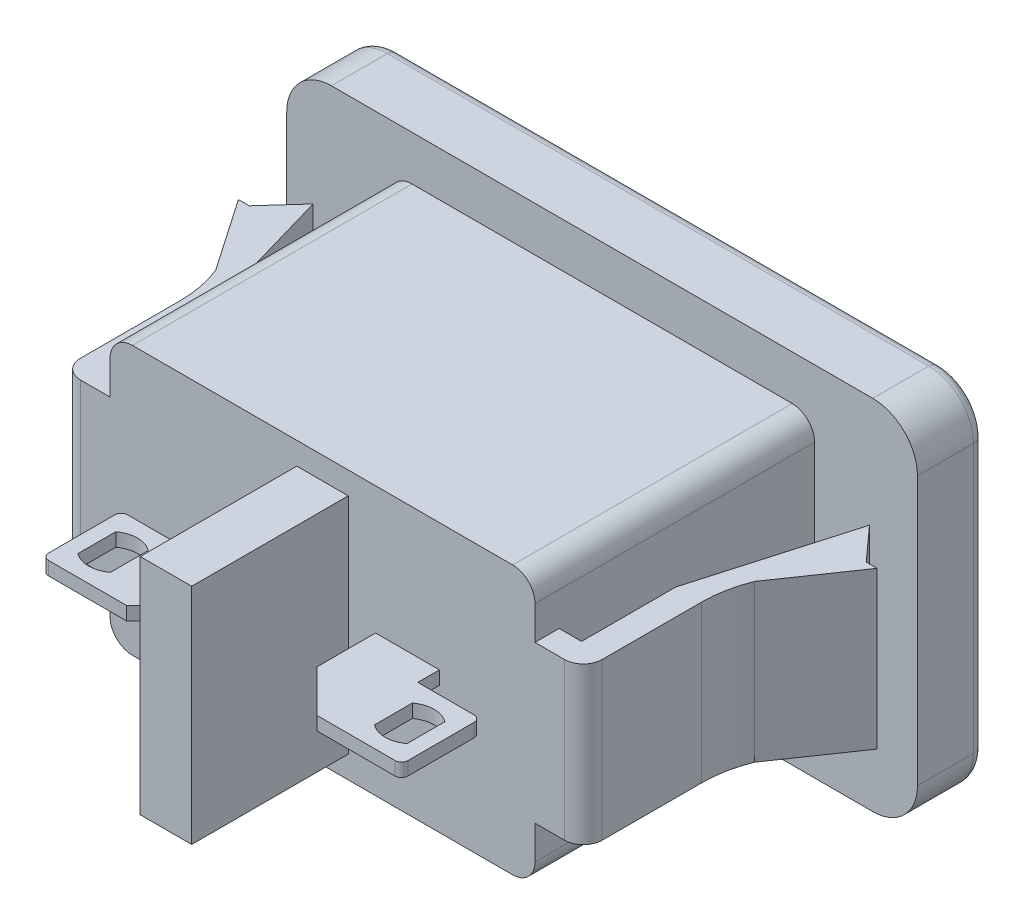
SolidWorks part; units mm, degrees
ref_plane "Front Plane" through (0, 0, 0) normal (0, 0, 1) x (1, 0, 0)
ref_plane "Top Plane" through (0, 0, 0) normal (0, 1, 0) x (1, 0, 0)
ref_plane "Center Plane" through (0, 0, 0) normal (1, 0, 0) x (0, 0, -1)
sketch "Sketch8" plane through (0, 0, 0) normal (0, 0, 1) x (1, 0, 0)
  line L0 (-1.1792, 0) -> (-1.2283, 0.4422)
  line L1 (-1.2283, 0.4422) -> (-1.2774, 0.737)
  line L2 (-1.3266, 0.8844) -> (-1.3757, 0.9826)
  line L3 (-1.4248, 1.13) -> (-1.474, 1.2774)
  line L4 (-1.474, 1.2774) -> (-1.6705, 1.6705)
  line L5 (-1.6705, 1.6705) -> (-1.7688, 1.7688)
  line L6 (-1.867, 1.9161) -> (-1.9161, 2.0144)
  line L7 (-2.0144, 2.0635) -> (-2.2601, 2.3583)
  line L8 (-2.2601, 2.3583) -> (-2.604, 2.604)
  line L9 (-2.7023, 2.6531) -> (-2.8005, 2.7023)
  line L10 (-2.9479, 2.8005) -> (-3.0462, 2.8497)
  line L11 (-3.0462, 2.8497) -> (-3.4392, 2.997)
  line L12 (-3.4392, 2.997) -> (-3.6849, 3.0462)
  line L13 (-3.7832, 3.0953) -> (-3.8814, 3.0953)
  line L14 (-3.8814, 3.0953) -> (-3.9306, 3.0953)
  line L15 (-4.0288, 3.0953) -> (-4.3236, 3.1444)
  line L16 (-4.3236, 3.1444) -> (-4.7658, 3.0953)
  line L17 (-4.7658, 3.0953) -> (-4.8149, 3.0953)
  line L18 (-4.9623, 3.0462) -> (-5.0606, 3.0462)
  line L19 (-5.208, 2.997) -> (-5.6502, 2.8497)
  line L20 (-5.6502, 2.8497) -> (-5.8958, 2.7023)
  line L21 (-6.0432, 2.6531) -> (-6.1415, 2.5549)
  line L22 (-6.2398, 2.4566) -> (-6.3872, 2.3583)
  line L23 (-6.3872, 2.3583) -> (-6.7311, 2.0144)
  line L24 (-6.7311, 2.0144) -> (-6.7802, 1.9653)
  line L25 (-6.8785, 1.8179) -> (-6.9276, 1.7196)
  line L26 (-7.0259, 1.6214) -> (-7.2224, 1.2774)
  line L27 (-7.2224, 1.2774) -> (-7.3207, 0.9335)
  line L28 (-7.3698, 0.8352) -> (-7.4189, 0.6878)
  line L29 (-7.4189, 0.5405) -> (-7.4681, 0.4422)
  line L30 (-7.4681, 0.4422) -> (-7.5172, 0)
  line L31 (-7.5172, 0) -> (-7.4681, -0.1965)
  line L32 (-7.4681, -0.3439) -> (-7.4681, -0.4913)
  line L33 (-7.4189, -0.5896) -> (-7.3698, -0.9335)
  line L34 (-7.3698, -0.9335) -> (-7.2224, -1.3266)
  line L35 (-7.2224, -1.3266) -> (-7.1733, -1.3266)
  line L36 (-7.1241, -1.474) -> (-7.075, -1.5722)
  line L37 (-7.0259, -1.6705) -> (-6.9767, -1.7196)
  line L38 (-6.9767, -1.7196) -> (-6.7311, -2.0635)
  line L39 (-6.7311, -2.0635) -> (-6.5345, -2.2601)
  line L40 (-6.4363, -2.3583) -> (-6.338, -2.4566)
  line L41 (-6.2398, -2.5057) -> (-6.0432, -2.6531)
  line L42 (-6.0432, -2.6531) -> (-5.6502, -2.8988)
  line L43 (-5.6502, -2.8988) -> (-5.5519, -2.8988)
  line L44 (-5.4536, -2.9479) -> (-5.3062, -2.997)
  line L45 (-5.208, -3.0462) -> (-4.7658, -3.1444)
  line L46 (-4.7658, -3.1444) -> (-4.4219, -3.1444)
  line L47 (-4.3236, -3.1936) -> (-4.1762, -3.1444)
  line L48 (-4.0288, -3.1444) -> (-3.8814, -3.1444)
  line L49 (-3.8814, -3.1444) -> (-3.4392, -3.0462)
  line L50 (-3.4392, -3.0462) -> (-3.2918, -2.997)
  line L51 (-3.1936, -2.9479) -> (-3.0462, -2.8988)
  line L52 (-2.9479, -2.8497) -> (-2.6531, -2.6531)
  line L53 (-2.6531, -2.6531) -> (-2.3092, -2.4075)
  line L54 (-2.2109, -2.3583) -> (-2.1127, -2.2109)
  line L55 (-2.0144, -2.1618) -> (-1.9653, -2.0635)
  line L56 (-1.9653, -2.0635) -> (-1.6705, -1.7196)
  line L57 (-1.6705, -1.7196) -> (-1.5722, -1.5231)
  line L58 (-1.474, -1.3757) -> (-1.474, -1.3266)
  line L59 (-1.474, -1.3266) -> (-1.4248, -1.2774)
  line L60 (-1.4248, -1.1792) -> (-1.3266, -0.9335)
  line L61 (-1.3266, -0.9335) -> (-1.2283, -0.4913)
  line L62 (-1.2283, -0.4913) -> (-1.2283, -0.3931)
  line L64 (-3.1936, 0) -> (-3.1936, 0.2457)
  line L65 (-3.1936, 0.2457) -> (-3.2918, 0.4913)
  line L66 (-3.2918, 0.4913) -> (-3.4392, 0.6878)
  line L67 (-3.5375, 0.8352) -> (-3.6358, 0.8844)
  line L68 (-3.7832, 0.9826) -> (-3.8323, 1.0318)
  line L69 (-3.8323, 1.0318) -> (-4.078, 1.0809)
  line L70 (-4.078, 1.0809) -> (-4.3236, 1.13)
  line L71 (-4.3236, 1.13) -> (-4.5201, 1.0809)
  line L72 (-4.6675, 1.0809) -> (-4.7658, 1.0318)
  line L73 (-4.9132, 0.9826) -> (-5.0606, 0.8844)
  line L74 (-5.0606, 0.8844) -> (-5.208, 0.6878)
  line L75 (-5.208, 0.6878) -> (-5.3554, 0.4913)
  line L76 (-5.3554, 0.4913) -> (-5.4045, 0.3931)
  line L77 (-5.4536, 0.2457) -> (-5.4536, 0.0983)
  line L78 (-5.5028, 0) -> (-5.4536, -0.2948)
  line L79 (-5.4536, -0.2948) -> (-5.3554, -0.5405)
  line L80 (-5.3554, -0.5405) -> (-5.208, -0.737)
  line L81 (-5.1097, -0.8352) -> (-5.0606, -0.9335)
  line L82 (-5.0606, -0.9335) -> (-5.0115, -0.9335)
  line L83 (-4.9132, -1.0318) -> (-4.8641, -1.0809)
  line L84 (-4.8641, -1.0809) -> (-4.5693, -1.13)
  line L85 (-4.5693, -1.13) -> (-4.3236, -1.1792)
  line L86 (-4.3236, -1.1792) -> (-4.1271, -1.13)
  line L87 (-4.0288, -1.13) -> (-3.8814, -1.0809)
  line L88 (-3.7832, -1.0318) -> (-3.6358, -0.9335)
  line L89 (-3.6358, -0.9335) -> (-3.4392, -0.737)
  line L90 (-3.4392, -0.737) -> (-3.2918, -0.5405)
  line L91 (-3.2918, -0.5405) -> (-3.2427, -0.4422)
  line L92 (-3.1936, -0.2948) -> (-3.1936, -0.1474)
  line L93 (-4.471, 4.2253) -> (-5.0115, 4.1762)
  line L94 (-5.0115, 4.1762) -> (-5.1589, 4.1762)
  line L95 (-5.3062, 4.1271) -> (-5.4045, 4.1271)
  line L96 (-5.5519, 4.078) -> (-5.601, 4.0288)
  line L97 (-5.601, 4.0288) -> (-6.1415, 3.8323)
  line L98 (-6.1415, 3.8323) -> (-6.2398, 3.7832)
  line L99 (-6.338, 3.734) -> (-6.4363, 3.6849)
  line L100 (-6.5837, 3.5866) -> (-6.6328, 3.5866)
  line L101 (-6.6328, 3.5866) -> (-7.075, 3.2427)
  line L102 (-7.075, 3.2427) -> (-7.1733, 3.1444)
  line L103 (-7.2715, 3.0462) -> (-7.3698, 2.9479)
  line L104 (-7.4189, 2.8988) -> (-7.5172, 2.8497)
  line L105 (-7.5172, 2.8497) -> (-7.8611, 2.4075)
  line L106 (-7.8611, 2.4075) -> (-7.9102, 2.3092)
  line L107 (-7.9594, 2.2109) -> (-8.0085, 2.0635)
  line L108 (-8.1068, 1.9653) -> (-8.1068, 1.9161)
  line L109 (-8.1068, 1.9161) -> (-8.3524, 1.3757)
  line L110 (-8.3524, 1.3757) -> (-8.4016, 1.2774)
  line L111 (-8.4016, 1.13) -> (-8.4507, 1.0318)
  line L112 (-8.4998, 0.9335) -> (-8.4998, 0.8352)
  line L113 (-8.4998, 0.8352) -> (-8.5981, 0.2457)
  line L114 (-8.5981, 0.2457) -> (-8.5981, 0.1474)
  line L115 (-8.5981, 0.0491) -> (-8.5981, -0.0983)
  line L116 (-8.5981, -0.1965) -> (-8.5981, -0.2948)
  line L117 (-8.5981, -0.2948) -> (-8.4998, -0.8844)
  line L118 (-8.4998, -0.8844) -> (-8.4998, -0.9335)
  line L119 (-8.4507, -1.0809) -> (-8.4016, -1.1792)
  line L120 (-8.4016, -1.3266) -> (-8.3524, -1.4248)
  line L121 (-8.3524, -1.4248) -> (-8.1068, -1.9653)
  line L122 (-8.1068, -1.9653) -> (-8.1068, -2.0144)
  line L123 (-8.0085, -2.1127) -> (-7.9594, -2.2601)
  line L124 (-7.9102, -2.3583) -> (-7.8611, -2.4566)
  line L125 (-7.8611, -2.4566) -> (-7.5172, -2.8988)
  line L126 (-7.5172, -2.8988) -> (-7.4189, -2.9479)
  line L127 (-7.3698, -3.0462) -> (-7.2715, -3.0953)
  line L128 (-7.1733, -3.1936) -> (-7.075, -3.2918)
  line L129 (-7.075, -3.2918) -> (-6.6328, -3.6358)
  line L130 (-6.6328, -3.6358) -> (-6.5837, -3.6849)
  line L131 (-6.4363, -3.734) -> (-6.338, -3.7832)
  line L132 (-6.2398, -3.8323) -> (-6.1415, -3.9306)
  line L133 (-6.1415, -3.9306) -> (-5.601, -4.1271)
  line L134 (-5.601, -4.1271) -> (-5.5519, -4.1271)
  line L135 (-5.4045, -4.1762) -> (-5.3062, -4.1762)
  line L136 (-5.1589, -4.2253) -> (-5.0115, -4.2253)
  line L137 (-5.0115, -4.2253) -> (-4.471, -4.2745)
  line L138 (-9.2859, 0) -> (-8.4016, 0)
  line L139 (-8.1559, 0) -> (-7.9102, 0)
  line L140 (-7.6646, 0) -> (-6.3872, 0)
  line L141 (-6.1415, 0) -> (-5.8958, 0)
  line L142 (-5.6502, 0) -> (-4.4219, 0)
  line L143 (-4.1271, 0) -> (-3.8814, 0)
  line L144 (-3.6358, 0) -> (-2.3583, 0)
  line L145 (-2.1127, 0) -> (-1.867, 0)
  line L150 (2.4075, 0) -> (3.6849, 0)
  line L151 (3.9306, 0) -> (4.1762, 0)
  line L152 (4.4219, 0) -> (5.6993, 0)
  line L153 (5.945, 0) -> (6.1906, 0)
  line L154 (6.4363, 0) -> (7.7137, 0)
  line L155 (7.9594, 0) -> (8.205, 0)
  line L156 (8.4507, 0) -> (9.2859, 0)
  line L157 (-6.2889, 0.7861) -> (-6.2889, 0.1474)
  line L158 (-6.2889, 0.0491) -> (-6.2889, -0.0983)
  line L159 (-6.2889, -0.1965) -> (-6.2889, -0.8352)
  line L160 (-6.2889, -0.8352) -> (-5.1589, -0.8352)
  line L161 (-6.2889, 0.7861) -> (-5.1589, 0.7861)
  line L162 (6.338, 0.7861) -> (6.338, 0.1474)
  line L163 (6.338, 0.0491) -> (6.338, -0.0983)
  line L164 (6.338, -0.1965) -> (6.338, -0.8352)
  line L165 (7.5172, 0) -> (7.4681, 0.4422)
  line L166 (7.4681, 0.4422) -> (7.4189, 0.737)
  line L167 (7.4189, 0.8844) -> (7.3698, 0.9826)
  line L168 (7.2715, 1.13) -> (7.2224, 1.2774)
  line L169 (7.2224, 1.2774) -> (7.0259, 1.6705)
  line L170 (7.0259, 1.6705) -> (6.9276, 1.7687)
  line L171 (6.8293, 1.9161) -> (6.7802, 2.0144)
  line L172 (6.6819, 2.0635) -> (6.4363, 2.3583)
  line L173 (6.4363, 2.3583) -> (6.0924, 2.604)
  line L174 (5.9941, 2.6531) -> (5.8958, 2.7023)
  line L175 (5.7484, 2.8005) -> (5.6993, 2.8497)
  line L176 (5.6993, 2.8497) -> (5.2571, 2.997)
  line L177 (5.2571, 2.997) -> (5.0606, 3.0462)
  line L178 (4.9132, 3.0953) -> (4.8149, 3.0953)
  line L179 (4.8149, 3.0953) -> (4.7658, 3.0953)
  line L180 (4.6675, 3.0953) -> (4.3727, 3.1444)
  line L181 (4.3727, 3.1444) -> (3.9306, 3.0953)
  line L182 (3.9306, 3.0953) -> (3.8814, 3.0953)
  line L183 (3.734, 3.0462) -> (3.6358, 3.0462)
  line L184 (3.4884, 2.997) -> (3.0462, 2.8497)
  line L185 (3.0462, 2.8497) -> (2.8005, 2.7023)
  line L186 (2.6531, 2.6531) -> (2.5549, 2.5549)
  line L187 (2.5057, 2.4566) -> (2.3092, 2.3583)
  line L188 (2.3092, 2.3583) -> (1.9653, 2.0144)
  line L189 (1.9653, 2.0144) -> (1.9161, 1.9653)
  line L190 (1.867, 1.8179) -> (1.7688, 1.7196)
  line L191 (1.6705, 1.6214) -> (1.5231, 1.2774)
  line L192 (1.5231, 1.2774) -> (1.3757, 0.9335)
  line L193 (1.3266, 0.8352) -> (1.2774, 0.6878)
  line L197 (1.2283, -0.3439) -> (1.2283, -0.4913)
  line L198 (1.2774, -0.5896) -> (1.3266, -0.9335)
  line L199 (1.3266, -0.9335) -> (1.5231, -1.3266)
  line L200 (1.5722, -1.474) -> (1.6214, -1.5722)
  line L201 (1.6705, -1.6705) -> (1.7196, -1.7196)
  line L202 (1.7196, -1.7196) -> (1.9653, -2.0635)
  line L203 (1.9653, -2.0635) -> (2.1618, -2.2601)
  line L204 (2.2601, -2.3583) -> (2.3092, -2.4075)
  line L205 (2.3092, -2.4075) -> (2.3583, -2.4566)
  line L206 (2.5057, -2.5057) -> (2.6531, -2.6531)
  line L207 (2.6531, -2.6531) -> (3.0462, -2.8988)
  line L208 (3.0462, -2.8988) -> (3.1444, -2.8988)
  line L209 (3.2427, -2.9479) -> (3.3901, -2.997)
  line L210 (3.4884, -3.0462) -> (3.9306, -3.1444)
  line L211 (3.9306, -3.1444) -> (4.2745, -3.1444)
  line L212 (4.4219, -3.1936) -> (4.5201, -3.1444)
  line L213 (4.6675, -3.1444) -> (4.8149, -3.1444)
  line L214 (4.8149, -3.1444) -> (5.2571, -3.0462)
  line L215 (5.2571, -3.0462) -> (5.4045, -2.997)
  line L216 (5.5519, -2.9479) -> (5.6502, -2.8988)
  line L217 (5.7484, -2.8497) -> (6.0924, -2.6531)
  line L218 (6.0924, -2.6531) -> (6.4363, -2.4075)
  line L219 (6.5345, -2.3583) -> (6.5837, -2.2109)
  line L220 (6.6819, -2.1618) -> (6.7311, -2.0635)
  line L221 (6.7311, -2.0635) -> (7.0259, -1.7196)
  line L222 (7.0259, -1.7196) -> (7.1241, -1.5231)
  line L223 (7.2224, -1.3757) -> (7.2224, -1.3266)
  line L224 (7.2224, -1.3266) -> (7.2715, -1.2774)
  line L225 (7.2715, -1.1792) -> (7.4189, -0.9335)
  line L226 (7.4189, -0.9335) -> (7.4681, -0.4913)
  line L227 (7.4681, -0.4913) -> (7.4681, -0.3931)
  line L228 (7.5172, -0.2948) -> (7.5172, -0.1474)
  line L229 (5.5028, 0) -> (5.5028, 0.2457)
  line L230 (5.5028, 0.2457) -> (5.4045, 0.4913)
  line L231 (5.4045, 0.4913) -> (5.2571, 0.6878)
  line L232 (5.1589, 0.8352) -> (5.0606, 0.8844)
  line L233 (4.9623, 0.9826) -> (4.8641, 1.0318)
  line L234 (4.8641, 1.0318) -> (4.6184, 1.0809)
  line L235 (4.6184, 1.0809) -> (4.3727, 1.13)
  line L236 (4.3727, 1.13) -> (4.1762, 1.0809)
  line L237 (4.0288, 1.0809) -> (3.9306, 1.0318)
  line L238 (3.7832, 0.9826) -> (3.6358, 0.8844)
  line L239 (3.6358, 0.8844) -> (3.4884, 0.6878)
  line L240 (3.4884, 0.6878) -> (3.341, 0.4913)
  line L241 (3.341, 0.4913) -> (3.2918, 0.3931)
  line L242 (3.2427, 0.2457) -> (3.2427, 0.0983)
  line L243 (3.2427, 0) -> (3.2427, -0.2948)
  line L244 (3.2427, -0.2948) -> (3.341, -0.5405)
  line L245 (3.341, -0.5405) -> (3.4884, -0.737)
  line L246 (3.5866, -0.8352) -> (3.6358, -0.9335)
  line L247 (3.6358, -0.9335) -> (3.6849, -0.9335)
  line L248 (3.7832, -1.0318) -> (3.8814, -1.0809)
  line L249 (3.8814, -1.0809) -> (4.1271, -1.13)
  line L250 (4.1271, -1.13) -> (4.3727, -1.1792)
  line L251 (4.3727, -1.1792) -> (4.5693, -1.13)
  line L252 (4.7167, -1.13) -> (4.8149, -1.0809)
  line L253 (4.9623, -1.0318) -> (5.0606, -0.9335)
  line L254 (5.0606, -0.9335) -> (5.2571, -0.737)
  line L255 (5.2571, -0.737) -> (5.4045, -0.5405)
  line L256 (5.4045, -0.5405) -> (5.4536, -0.4422)
  line L257 (5.5028, -0.2948) -> (5.5028, -0.1474)
  line L258 (4.5201, -4.2745) -> (5.0606, -4.2253)
  line L259 (5.0606, -4.2253) -> (5.208, -4.2253)
  line L260 (5.3062, -4.1762) -> (5.4536, -4.1762)
  line L261 (5.5519, -4.1271) -> (5.6502, -4.1271)
  line L262 (5.6502, -4.1271) -> (6.1415, -3.9306)
  line L263 (6.1415, -3.9306) -> (6.2889, -3.8323)
  line L264 (6.3872, -3.7832) -> (6.4854, -3.734)
  line L265 (6.5837, -3.6849) -> (6.6328, -3.6358)
  line L266 (6.6328, -3.6358) -> (7.1241, -3.2918)
  line L267 (7.1241, -3.2918) -> (7.2224, -3.1936)
  line L268 (7.2715, -3.0953) -> (7.3698, -3.0462)
  line L269 (7.4681, -2.9479) -> (7.5172, -2.8988)
  line L270 (7.5172, -2.8988) -> (7.8611, -2.4566)
  line L271 (7.8611, -2.4566) -> (7.9102, -2.3583)
  line L272 (8.0085, -2.2601) -> (8.0576, -2.1127)
  line L273 (8.1068, -2.0144) -> (8.1559, -1.9653)
  line L274 (8.1559, -1.9653) -> (8.4016, -1.4248)
  line L275 (8.4016, -1.4248) -> (8.4016, -1.3266)
  line L276 (8.4507, -1.1792) -> (8.4998, -1.0809)
  line L277 (8.4998, -0.9335) -> (8.549, -0.8844)
  line L278 (8.549, -0.8844) -> (8.5981, -0.2948)
  line L279 (8.5981, -0.2948) -> (8.5981, -0.1965)
  line L280 (8.5981, -0.0983) -> (8.5981, 0.0491)
  line L281 (8.5981, 0.1474) -> (8.5981, 0.2457)
  line L282 (8.5981, 0.2457) -> (8.549, 0.8352)
  line L283 (8.549, 0.8352) -> (8.4998, 0.9335)
  line L284 (8.4998, 1.0318) -> (8.4507, 1.13)
  line L285 (8.4016, 1.2774) -> (8.4016, 1.3757)
  line L286 (8.4016, 1.3757) -> (8.1559, 1.9161)
  line L287 (8.1559, 1.9161) -> (8.1068, 1.9653)
  line L288 (8.0576, 2.0635) -> (8.0085, 2.2109)
  line L289 (7.9102, 2.3092) -> (7.8611, 2.4075)
  line L290 (7.8611, 2.4075) -> (7.5172, 2.8497)
  line L291 (7.5172, 2.8497) -> (7.4681, 2.8988)
  line L292 (7.3698, 2.9479) -> (7.2715, 3.0462)
  line L293 (7.2224, 3.1444) -> (7.1241, 3.2427)
  line L294 (7.1241, 3.2427) -> (6.6328, 3.5866)
  line L295 (6.6328, 3.5866) -> (6.5837, 3.5866)
  line L296 (6.4854, 3.6849) -> (6.3872, 3.734)
  line L297 (6.2889, 3.7832) -> (6.1415, 3.8323)
  line L298 (6.1415, 3.8323) -> (5.6502, 4.0288)
  line L299 (5.6502, 4.0288) -> (5.5519, 4.078)
  line L300 (5.4536, 4.1271) -> (5.3062, 4.1271)
  line L301 (5.208, 4.1762) -> (5.0606, 4.1762)
  line L302 (5.0606, 4.1762) -> (4.5201, 4.2253)
  line L303 (4.3727, -1.2774) -> (4.3727, -0.3931)
  line L304 (4.3727, -0.1474) -> (4.3727, 0.0983)
  line L305 (4.3727, 0.3439) -> (4.3727, 1.2283)
  line L306 (-4.3236, -1.2774) -> (-4.3236, -0.3931)
  line L307 (-4.3236, -0.1474) -> (-4.3236, 0.0983)
  line L308 (-4.3236, 0.3439) -> (-4.3236, 1.2283)
  line L313 (0, -1.4248) -> (0, -2.2109)
  line L314 (1.6705, -4.0288) -> (1.7687, -4.1762)
  line L315 (1.7687, -4.1762) -> (1.9653, -4.2745)
  line L316 (1.9653, -4.2745) -> (2.1127, -4.2745)
  line L317 (-0.8844, -2.7514) -> (-1.1792, -3.2427)
  line L318 (-1.2283, -3.341) -> (-1.3266, -3.4392)
  line L319 (-1.3757, -3.5375) -> (-1.6214, -4.0288)
  line L320 (-4.471, -4.2745) -> (-4.0288, -4.2745)
  line L321 (-3.8814, -4.2745) -> (-3.7832, -4.2745)
  line L322 (-3.6358, -4.2745) -> (-2.8988, -4.2745)
  line L323 (-2.7514, -4.2745) -> (-2.6531, -4.2745)
  line L324 (-2.5057, -4.2745) -> (-2.1127, -4.2745)
  line L325 (-2.1127, -4.2745) -> (-1.9161, -4.2745)
  line L326 (-1.9161, -4.2745) -> (-1.7688, -4.1762)
  line L327 (-1.7688, -4.1762) -> (-1.6214, -4.0288)
  line L328 (0.9335, -2.7514) -> (0.737, -2.5057)
  line L329 (0.737, -2.5057) -> (0.5405, -2.3583)
  line L330 (0.5405, -2.3583) -> (0.2948, -2.2601)
  line L331 (0.2948, -2.2601) -> (0.1965, -2.2601)
  line L332 (0.0983, -2.2109) -> (0, -2.2109)
  line L333 (0, -2.2109) -> (-0.0491, -2.2109)
  line L334 (-0.1474, -2.2601) -> (-0.2457, -2.2601)
  line L335 (-0.2457, -2.2601) -> (-0.4913, -2.3583)
  line L336 (-0.4913, -2.3583) -> (-0.737, -2.5057)
  line L337 (-0.737, -2.5057) -> (-0.8844, -2.7514)
  line L338 (0.9335, -2.7514) -> (1.2283, -3.2427)
  line L339 (1.2774, -3.341) -> (1.3266, -3.4392)
  line L340 (1.3757, -3.5375) -> (1.6705, -4.0288)
  line L341 (5.208, -0.8352) -> (6.338, -0.8352)
  line L342 (2.1127, -4.2745) -> (2.5549, -4.2745)
  line L343 (2.6531, -4.2745) -> (2.8005, -4.2745)
  line L344 (2.9479, -4.2745) -> (3.6849, -4.2745)
  line L345 (3.8323, -4.2745) -> (3.9306, -4.2745)
  line L346 (4.078, -4.2745) -> (4.5201, -4.2745)
  line L347 (2.1127, 4.2253) -> (1.9653, 4.2253)
  line L348 (1.9653, 4.2253) -> (1.7687, 4.1271)
  line L349 (1.7687, 4.1271) -> (1.6705, 3.9797)
  line L350 (-0.8844, 2.7023) -> (-1.1792, 3.1936)
  line L351 (-1.2283, 3.2918) -> (-1.3266, 3.3901)
  line L352 (-1.3757, 3.4884) -> (-1.6214, 3.9797)
  line L353 (-4.471, 4.2253) -> (-4.0288, 4.2253)
  line L354 (-3.8814, 4.2253) -> (-3.7832, 4.2253)
  line L355 (-3.6358, 4.2253) -> (-2.8988, 4.2253)
  line L356 (-2.7514, 4.2253) -> (-2.6531, 4.2253)
  line L357 (-2.5057, 4.2253) -> (-2.1127, 4.2253)
  line L358 (-1.6214, 3.9797) -> (-1.7688, 4.1271)
  line L359 (-1.7688, 4.1271) -> (-1.9161, 4.2253)
  line L360 (-1.9161, 4.2253) -> (-2.1127, 4.2253)
  line L361 (0.9335, 2.7023) -> (1.2283, 3.1936)
  line L362 (1.2774, 3.2918) -> (1.3266, 3.3901)
  line L363 (1.3757, 3.4884) -> (1.6705, 3.9797)
  line L364 (-0.8844, 2.7023) -> (-0.737, 2.4566)
  line L365 (-0.737, 2.4566) -> (-0.4913, 2.3092)
  line L366 (-0.4913, 2.3092) -> (-0.2457, 2.2109)
  line L370 (0.1965, 2.2109) -> (0.2948, 2.2109)
  line L371 (0.2948, 2.2109) -> (0.5405, 2.3092)
  line L372 (0.5405, 2.3092) -> (0.737, 2.4566)
  line L373 (0.737, 2.4566) -> (0.9335, 2.7023)
  line L374 (5.208, 0.7861) -> (6.338, 0.7861)
  line L375 (2.1127, 4.2253) -> (2.5549, 4.2253)
  line L376 (2.6531, 4.2253) -> (2.8005, 4.2253)
  line L377 (2.9479, 4.2253) -> (3.6849, 4.2253)
  line L378 (3.8323, 4.2253) -> (3.9306, 4.2253)
  line L379 (4.078, 4.2253) -> (4.5201, 4.2253)
  line L380 (9.2859, 0) -> (-9.2859, 0)
  line L381 (0, 5.4932) -> (0, -5.2033)
sketch "Sketch9" plane through (0, 0, 0) normal (0, 1, 0) x (1, 0, 0)
  line L90 (-5.4202, -13.599) -> (-5.4202, -12.6311)
  line L91 (2.3714, -12.6311) -> (2.3714, -15.2444)
  line L92 (5.4202, -12.9215) -> (5.4202, -12.6311)
  line L93 (5.2267, -12.9215) -> (5.2267, -13.599)
  line L94 (6.6301, -13.115) -> (6.6301, -17.4222)
  line L95 (5.9042, -14.5185) -> (5.9042, -16.2123)
  line L96 (5.2267, -13.7926) -> (5.2267, -16.9382)
  line L97 (8.0336, -13.9377) -> (7.9852, -13.7926)
  line L98 (7.9852, -13.7926) -> (7.8884, -13.6474)
  line L99 (7.8884, -13.6474) -> (7.7432, -13.599)
  line L100 (7.7432, -17.1318) -> (7.8884, -17.1318)
  line L101 (7.8884, -17.1318) -> (7.9852, -16.9866)
  line L102 (7.9852, -16.9866) -> (8.0336, -16.8414)
  line L103 (8.0336, -13.9377) -> (8.0336, -16.8414)
  line L104 (7.356, -14.5185) -> (7.356, -16.2123)
  line L105 (8.3239, -15.3896) -> (5.2751, -15.3896)
  line L106 (7.7432, -17.1318) -> (4.2588, -17.1318)
  line L107 (7.7432, -13.599) -> (5.2267, -13.599)
  line L108 (5.9042, -16.2123) -> (6.2913, -16.4059)
  line L109 (6.2913, -16.4059) -> (6.6301, -16.4543)
  line L110 (6.6301, -16.4543) -> (7.0173, -16.4059)
  line L111 (7.0173, -16.4059) -> (7.356, -16.2123)
  line L112 (7.356, -14.5185) -> (7.0173, -14.3249)
  line L113 (7.0173, -14.3249) -> (6.6301, -14.2765)
  line L114 (6.6301, -14.2765) -> (6.2913, -14.3249)
  line L115 (6.2913, -14.3249) -> (5.9042, -14.5185)
  line L116 (5.4202, -12.9215) -> (2.3714, -12.9215)
  line L117 (2.3714, -15.2444) -> (4.2588, -17.1318)
  line L118 (1.2099, 0) -> (1.2099, -19.3096)
  line L119 (1.2099, -19.3096) -> (0, -19.3096)
  line L120 (13.9378, 3) -> (13.9378, 0)
  line L121 (12.4375, -0.4839) -> (13.7926, -1.9842)
  line L122 (13.7926, -1.9842) -> (14.2765, -1.9842)
  line L123 (12.0503, -5.2267) -> (11.6632, -7.2108)
  line L124 (10.5017, -11.4212) -> (9.7274, -11.4212)
  line L125 (11.6632, -7.2108) -> (11.6632, -11.6148)
  line L126 (10.5017, -7.2108) -> (10.5017, -11.4212)
  line L127 (10.6953, -12.6311) -> (11.0341, -12.5343)
  line L128 (11.0341, -12.5343) -> (11.276, -12.4375)
  line L129 (11.276, -12.4375) -> (11.4696, -12.1955)
  line L130 (11.4696, -12.1955) -> (11.6632, -11.9052)
  line L131 (11.6632, -11.9052) -> (11.6632, -11.6148)
  line L132 (12.4375, -0.4839) -> (10.5017, -7.2108)
  line L133 (14.2765, -1.9842) -> (12.0503, -5.2267)
  line L134 (9.7274, 0) -> (9.7274, -12.6311)
  line L135 (13.9378, 0) -> (0, 0)
  line L136 (10.6953, -12.6311) -> (-1.2583, -12.6311)
  line L137 (13.9378, 3) -> (0, 3)
  line L138 (-2.3714, -12.6311) -> (-2.3714, -15.2444)
  line L139 (-5.4202, -16.7931) -> (-5.4202, -14.0345)
  line L140 (-2.3714, -15.2444) -> (-4.3072, -17.1318)
  line L141 (-10.5017, -7.2108) -> (-10.5017, -11.4212)
  line L142 (-10.5017, -11.4212) -> (-9.7274, -11.4212)
  line L143 (-7.7432, -13.599) -> (-7.8884, -13.6474)
  line L144 (-7.8884, -13.6474) -> (-8.0336, -13.7926)
  line L145 (-8.0336, -13.7926) -> (-8.082, -13.9378)
  line L146 (-5.9526, -14.5185) -> (-6.2913, -14.3249)
  line L147 (-6.2913, -14.3249) -> (-6.6785, -14.2765)
  line L148 (-6.6785, -14.2765) -> (-7.0173, -14.3249)
  line L149 (-7.0173, -14.3249) -> (-7.356, -14.5185)
  line L150 (-8.082, -16.8414) -> (-8.0336, -16.9866)
  line L151 (-8.0336, -16.9866) -> (-7.8884, -17.1318)
  line L152 (-7.8884, -17.1318) -> (-7.7432, -17.1318)
  line L153 (-7.356, -14.5185) -> (-7.356, -16.2123)
  line L154 (-7.356, -16.2123) -> (-7.0173, -16.4059)
  line L155 (-7.0173, -16.4059) -> (-6.6785, -16.4543)
  line L156 (-6.6785, -16.4543) -> (-6.2913, -16.4059)
  line L157 (-6.2913, -16.4059) -> (-5.9526, -16.2123)
  line L158 (-5.9526, -14.5185) -> (-5.9526, -16.2123)
  line L159 (-6.6785, -13.115) -> (-6.6785, -17.4222)
  line L160 (-8.082, -13.9378) -> (-8.082, -16.8414)
  line L161 (-10.6953, -12.6311) -> (-1.2583, -12.6311)
  line L162 (-7.7432, -13.599) -> (-5.4202, -13.599)
  line L163 (-7.7432, -17.1318) -> (-4.3072, -17.1318)
  line L164 (-8.3239, -15.3896) -> (-5.3234, -15.3896)
  line L165 (-9.7274, 0) -> (-9.7274, -12.6311)
  line L166 (0, -19.3096) -> (-1.2583, -19.3096)
  line L167 (-1.2583, -19.3096) -> (-1.2583, 0)
  line L168 (-13.9861, 3) -> (-13.9861, 0)
  line L169 (-12.4375, -0.4839) -> (-13.7926, -1.9842)
  line L170 (-13.7926, -1.9842) -> (-14.2765, -1.9842)
  line L171 (-11.7116, -11.6148) -> (-11.7116, -7.2108)
  line L172 (-11.7116, -7.2108) -> (-12.0503, -5.2267)
  line L173 (-14.2765, -1.9842) -> (-12.0503, -5.2267)
  line L174 (-13.9861, 3) -> (0, 3)
  line L175 (-13.9861, 0) -> (0, 0)
  line L176 (-12.4375, -0.4839) -> (-10.5017, -7.2108)
  line L177 (-11.7116, -11.6148) -> (-11.6632, -11.9052)
  line L178 (-11.6632, -11.9052) -> (-11.518, -12.1955)
  line L179 (-11.518, -12.1955) -> (-11.276, -12.4375)
  line L180 (-11.276, -12.4375) -> (-11.0341, -12.5343)
  line L181 (-11.0341, -12.5343) -> (-10.6953, -12.6311)
  line L182 (2.3714, -11.4696) -> (2.323, -11.4696)
  line L183 (-2.081, -1.6938) -> (-2.081, -11.518)
  line L184 (-2.081, -11.518) -> (-7.4044, -11.518)
  line L185 (-7.4044, -1.6938) -> (-2.081, -1.6938)
  line L186 (-8.1304, 0) -> (-8.1304, -12.6311)
  line L187 (7.4044, -1.6938) -> (7.4044, -11.518)
  line L188 (7.4044, -11.518) -> (7.4044, -1.6938)
  line L189 (2.081, -1.6938) -> (2.081, -11.518)
  line L190 (2.081, -11.518) -> (2.081, -1.6938)
  line L191 (7.4044, -11.518) -> (2.081, -11.518)
  line L192 (2.081, -11.518) -> (7.4044, -11.518)
  line L193 (7.4044, -1.6938) -> (2.081, -1.6938)
  line L194 (2.081, -1.6938) -> (7.4044, -1.6938)
  line L195 (8.1304, 0) -> (8.1304, -12.6311)
  line L286 (-5.4202, -13.599) -> (-5.4202, -12.6311)
  line L287 (2.3714, -12.6311) -> (2.3714, -15.2444)
  line L288 (5.4202, -12.9215) -> (5.4202, -12.6311)
  line L289 (5.2267, -12.9215) -> (5.2267, -13.599)
  line L290 (6.6301, -13.115) -> (6.6301, -17.4222)
  line L291 (5.9042, -14.5185) -> (5.9042, -16.2123)
  line L292 (5.2267, -13.7926) -> (5.2267, -16.9382)
  line L293 (8.0336, -13.9377) -> (7.9852, -13.7926)
  line L294 (7.9852, -13.7926) -> (7.8884, -13.6474)
  line L295 (7.8884, -13.6474) -> (7.7432, -13.599)
  line L296 (7.7432, -17.1318) -> (7.8884, -17.1318)
  line L297 (7.8884, -17.1318) -> (7.9852, -16.9866)
  line L298 (7.9852, -16.9866) -> (8.0336, -16.8414)
  line L299 (8.0336, -13.9377) -> (8.0336, -16.8414)
  line L300 (7.356, -14.5185) -> (7.356, -16.2123)
  line L301 (8.3239, -15.3896) -> (5.2751, -15.3896)
  line L302 (7.7432, -17.1318) -> (4.2588, -17.1318)
  line L303 (7.7432, -13.599) -> (5.2267, -13.599)
  line L304 (5.9042, -16.2123) -> (6.2913, -16.4059)
  line L305 (6.2913, -16.4059) -> (6.6301, -16.4543)
  line L306 (6.6301, -16.4543) -> (7.0173, -16.4059)
  line L307 (7.0173, -16.4059) -> (7.356, -16.2123)
  line L308 (7.356, -14.5185) -> (7.0173, -14.3249)
  line L309 (7.0173, -14.3249) -> (6.6301, -14.2765)
  line L310 (6.6301, -14.2765) -> (6.2913, -14.3249)
  line L311 (6.2913, -14.3249) -> (5.9042, -14.5185)
  line L312 (5.4202, -12.9215) -> (2.3714, -12.9215)
  line L313 (2.3714, -15.2444) -> (4.2588, -17.1318)
  line L314 (1.2099, 0) -> (1.2099, -19.3096)
  line L315 (1.2099, -19.3096) -> (0, -19.3096)
  line L316 (13.9378, 3) -> (13.9378, 0)
  line L317 (12.4375, -0.4839) -> (13.7926, -1.9842)
  line L318 (13.7926, -1.9842) -> (14.2765, -1.9842)
  line L319 (12.0503, -5.2267) -> (11.6632, -7.2108)
  line L320 (10.5017, -11.4212) -> (9.7274, -11.4212)
  line L321 (11.6632, -7.2108) -> (11.6632, -11.6148)
  line L322 (10.5017, -7.2108) -> (10.5017, -11.4212)
  line L323 (10.6953, -12.6311) -> (11.0341, -12.5343)
  line L324 (11.0341, -12.5343) -> (11.276, -12.4375)
  line L325 (11.276, -12.4375) -> (11.4696, -12.1955)
  line L326 (11.4696, -12.1955) -> (11.6632, -11.9052)
  line L327 (11.6632, -11.9052) -> (11.6632, -11.6148)
  line L328 (12.4375, -0.4839) -> (10.5017, -7.2108)
  line L329 (14.2765, -1.9842) -> (12.0503, -5.2267)
  line L330 (9.7274, 0) -> (9.7274, -12.6311)
  line L331 (13.9378, 0) -> (0, 0)
  line L332 (10.6953, -12.6311) -> (-1.2583, -12.6311)
  line L333 (13.9378, 3) -> (0, 3)
  line L334 (-2.3714, -12.6311) -> (-2.3714, -15.2444)
  line L335 (-5.4202, -16.7931) -> (-5.4202, -14.0345)
  line L336 (-2.3714, -15.2444) -> (-4.3072, -17.1318)
  line L337 (-10.5017, -7.2108) -> (-10.5017, -11.4212)
  line L338 (-10.5017, -11.4212) -> (-9.7274, -11.4212)
  line L339 (-7.7432, -13.599) -> (-7.8884, -13.6474)
  line L340 (-7.8884, -13.6474) -> (-8.0336, -13.7926)
  line L341 (-8.0336, -13.7926) -> (-8.082, -13.9378)
  line L342 (-5.9526, -14.5185) -> (-6.2913, -14.3249)
  line L343 (-6.2913, -14.3249) -> (-6.6785, -14.2765)
  line L344 (-6.6785, -14.2765) -> (-7.0173, -14.3249)
  line L345 (-7.0173, -14.3249) -> (-7.356, -14.5185)
  line L346 (-8.082, -16.8414) -> (-8.0336, -16.9866)
  line L347 (-8.0336, -16.9866) -> (-7.8884, -17.1318)
  line L348 (-7.8884, -17.1318) -> (-7.7432, -17.1318)
  line L349 (-7.356, -14.5185) -> (-7.356, -16.2123)
  line L350 (-7.356, -16.2123) -> (-7.0173, -16.4059)
  line L351 (-7.0173, -16.4059) -> (-6.6785, -16.4543)
  line L352 (-6.6785, -16.4543) -> (-6.2913, -16.4059)
  line L353 (-6.2913, -16.4059) -> (-5.9526, -16.2123)
  line L354 (-5.9526, -14.5185) -> (-5.9526, -16.2123)
  line L355 (-6.6785, -13.115) -> (-6.6785, -17.4222)
  line L356 (-8.082, -13.9378) -> (-8.082, -16.8414)
  line L357 (-10.6953, -12.6311) -> (-1.2583, -12.6311)
  line L358 (-7.7432, -13.599) -> (-5.4202, -13.599)
  line L359 (-7.7432, -17.1318) -> (-4.3072, -17.1318)
  line L360 (-8.3239, -15.3896) -> (-5.3234, -15.3896)
  line L361 (-9.7274, 0) -> (-9.7274, -12.6311)
  line L362 (0, -19.3096) -> (-1.2583, -19.3096)
  line L363 (-1.2583, -19.3096) -> (-1.2583, 0)
  line L364 (-13.9861, 3) -> (-13.9861, 0)
  line L365 (-12.4375, -0.4839) -> (-13.7926, -1.9842)
  line L366 (-13.7926, -1.9842) -> (-14.2765, -1.9842)
  line L367 (-11.7116, -11.6148) -> (-11.7116, -7.2108)
  line L368 (-11.7116, -7.2108) -> (-12.0503, -5.2267)
  line L369 (-14.2765, -1.9842) -> (-12.0503, -5.2267)
  line L370 (-13.9861, 3) -> (0, 3)
  line L371 (-13.9861, 0) -> (0, 0)
  line L372 (-12.4375, -0.4839) -> (-10.5017, -7.2108)
  line L373 (-11.7116, -11.6148) -> (-11.6632, -11.9052)
  line L374 (-11.6632, -11.9052) -> (-11.518, -12.1955)
  line L375 (-11.518, -12.1955) -> (-11.276, -12.4375)
  line L376 (-11.276, -12.4375) -> (-11.0341, -12.5343)
  line L377 (-11.0341, -12.5343) -> (-10.6953, -12.6311)
  line L378 (2.3714, -11.4696) -> (2.323, -11.4696)
  line L379 (-2.081, -1.6938) -> (-2.081, -11.518)
  line L380 (-2.081, -11.518) -> (-7.4044, -11.518)
  line L381 (-7.4044, -11.518) -> (-7.4044, -1.6938)
  line L382 (-7.4044, -1.6938) -> (-2.081, -1.6938)
  line L383 (-8.1304, 0) -> (-8.1304, -12.6311)
  line L384 (7.4044, -1.6938) -> (7.4044, -11.518)
  line L385 (7.4044, -11.518) -> (7.4044, -1.6938)
  line L386 (2.081, -1.6938) -> (2.081, -11.518)
  line L387 (2.081, -11.518) -> (2.081, -1.6938)
  line L388 (7.4044, -11.518) -> (2.081, -11.518)
  line L389 (2.081, -11.518) -> (7.4044, -11.518)
  line L390 (7.4044, -1.6938) -> (2.081, -1.6938)
  line L391 (2.081, -1.6938) -> (7.4044, -1.6938)
  line L392 (8.1304, 0) -> (8.1304, -12.6311)
  dimension "D1" = 3
sketch "Sketch1" plane through (0, 0, 0) normal (0, 0, 1) x (1, 0, 0)
  line L1 (-12.1, -8) -> (12.1, -8)
  line L2 (-14.1, -6) -> (-14.1, 6)
  line L3 (-12.1, 8) -> (12.1, 8)
  line L4 (14.1, -6) -> (14.1, 6)
  line L5 (-14.1, -8) -> (14.1, 8) construction
  line L6 (-14.1, 8) -> (14.1, -8) construction
  arc A0 (12.1, 8) -> (14.1, 6) centre (12.1, 6) cw
  arc A1 (12.1, -8) -> (14.1, -6) centre (12.1, -6) ccw
  arc A2 (-12.1, -8) -> (-14.1, -6) centre (-12.1, -6) cw
  arc A3 (-14.1, 6) -> (-12.1, 8) centre (-12.1, 6) cw
  point P0 (0, 0)
  dimension "D3" = 2
  dimension "D1" = 28.2
  dimension "D2" = 16
extrude "Boss-Extrude1" add sketch "Sketch1" against normal blind 3
sketch "Sketch3" plane through (0, 0, 0) normal (0, 0, 1) x (1, 0, 0)
  line L1 (-8.5, -6) -> (8.5, -6)
  line L2 (-9.5, -5) -> (-9.5, 5)
  line L3 (-8.5, 6) -> (8.5, 6)
  line L4 (9.5, -5) -> (9.5, 5)
  line L5 (-9.5, -6) -> (9.5, 6) construction
  line L6 (-9.5, 6) -> (9.5, -6) construction
  arc A0 (-8.5, -6) -> (-9.5, -5) centre (-8.5, -5) cw
  arc A1 (8.5, -6) -> (9.5, -5) centre (8.5, -5) ccw
  arc A2 (8.5, 6) -> (9.5, 5) centre (8.5, 5) cw
  arc A3 (-9.5, 5) -> (-8.5, 6) centre (-8.5, 5) cw
  point P0 (0, 0)
  dimension "D3" = 1
  dimension "D1" = 19
  dimension "D2" = 12
extrude "Boss-Extrude3" add sketch "Sketch3" along normal blind 12.5
sketch "Sketch10" plane through (0, 0, 0) normal (0, 1, 0) x (1, 0, 0)
  line L0 (12.4375, -0.4839) -> (13.7926, -1.9842)
  line L1 (13.7926, -1.9842) -> (14.2765, -1.9842)
  line L2 (14.2765, -1.9842) -> (12.0503, -5.2267)
  line L3 (11.6632, -7.2108) -> (11.6632, -11.6148) construction
  line L4 (11.6632, -7.2108) -> (11.6632, -11.6586)
  line L5 (9.5, -12.5) -> (10.8218, -12.5)
  line L6 (10.5017, -11.4212) -> (9.5, -11.4212)
  line L7 (10.5017, -11.4212) -> (10.5017, -7.2108)
  line L8 (10.5017, -7.2108) -> (12.4375, -0.4839)
  line L9 (9.5, -12.5) -> (9.5, -11.4212)
  line L11 (0, 0) -> (0, -14.9569) construction
  line L12 (-9.5, -12.5) -> (-9.5, -11.4212)
  line L13 (-10.5017, -7.2108) -> (-12.4375, -0.4839)
  line L14 (-10.5017, -11.4212) -> (-10.5017, -7.2108)
  line L15 (-10.5017, -11.4212) -> (-9.5, -11.4212)
  line L16 (-9.5, -12.5) -> (-10.8218, -12.5)
  line L17 (-11.6632, -7.2108) -> (-11.6632, -11.6586)
  line L18 (-14.2765, -1.9842) -> (-12.0503, -5.2267)
  line L19 (-13.7926, -1.9842) -> (-14.2765, -1.9842)
  line L20 (-12.4375, -0.4839) -> (-13.7926, -1.9842)
  arc A0 (11.6632, -7.2108) -> (12.0503, -5.2267) centre (16.9413, -7.2108) cw
  arc A1 (10.8218, -12.5) -> (11.6632, -11.6586) centre (10.8218, -11.6586) ccw
  arc A2 (-10.8218, -12.5) -> (-11.6632, -11.6586) centre (-10.8218, -11.6586) cw
  arc A3 (-11.6632, -7.2108) -> (-12.0503, -5.2267) centre (-16.9413, -7.2108) ccw
extrude "Boss-Extrude7" add sketch "Sketch10" along normal mid plane 7
sketch "Sketch4" plane through (0, 0, -3) normal (0, 0, 1) x (1, 0, 0)
  line L0 (-4.15, 0) -> (4.15, 0) construction
  line L1 (-1.6454, 3.85) -> (-0.866, 2.5)
  line L2 (0.866, 2.5) -> (1.6454, 3.85)
  line L3 (-4.15, 4.1) -> (-2.0785, 4.1)
  line L4 (-4.15, -4.1) -> (-2.0785, -4.1)
  line L5 (2.0785, 4.1) -> (4.15, 4.1)
  line L6 (0.866, -2.5) -> (1.6454, -3.85)
  line L7 (-1.6454, -3.85) -> (-0.866, -2.5)
  line L8 (2.0785, -4.1) -> (4.15, -4.1)
  line L9 (0, 3) -> (0, -3) construction
  arc A0 (-4.15, 4.1) -> (-4.15, -4.1) centre (-4.15, 0) ccw
  arc A1 (4.15, -4.1) -> (4.15, 4.1) centre (4.15, 0) ccw
  arc A2 (-0.866, 2.5) -> (0.866, 2.5) centre (0, 3) ccw
  arc A3 (-0.866, -2.5) -> (0.866, -2.5) centre (0, -3) cw
  arc A4 (-1.6454, -3.85) -> (-2.0785, -4.1) centre (-2.0785, -3.6) cw
  arc A5 (1.6454, -3.85) -> (2.0785, -4.1) centre (2.0785, -3.6) ccw
  arc A6 (1.6454, 3.85) -> (2.0785, 4.1) centre (2.0785, 3.6) cw
  arc A7 (-1.6454, 3.85) -> (-2.0785, 4.1) centre (-2.0785, 3.6) ccw
  point P5 (8.25, 0)
  point P6 (-8.25, 0)
  point P22 (-1.7898, -4.1)
  point P25 (1.7898, -4.1)
  point P28 (1.7898, 4.1)
  point P31 (-1.7898, 4.1)
  dimension "D1" = 8.2
  dimension "D4" = 1
  dimension "D6" = 0.5
  dimension "D2" = 16.5
  dimension "D3" = 60
  dimension "D5" = 6
extrude "Cut-Extrude1" cut sketch "Sketch4" along normal blind 13.6
sketch "Sketch5" plane through (0, 0, 12.5) normal (0, 0, 1) x (1, 0, 0)
  line L1 (-1.15, -5) -> (1.15, -5)
  line L2 (-1.15, -5) -> (-1.15, 5)
  line L3 (-1.15, 5) -> (1.15, 5)
  line L4 (1.15, -5) -> (1.15, 5)
  line L5 (-1.15, -5) -> (1.15, 5) construction
  line L6 (-1.15, 5) -> (1.15, -5) construction
  point P0 (0, 0)
  dimension "D1" = 2.3
  dimension "D2" = 10
extrude "Boss-Extrude4" add sketch "Sketch5" along normal offset from surface (7 mm away) 22.5
sketch "Sketch7" plane through (0, 0, 10.6) normal (0, 0, -1) x (-1, 0, 0)
  line L0 (-4.3, 0) -> (4.3, 0) construction
  circle A0 centre (-4.3, 0) radius 3.15
  circle A1 centre (4.3, 0) radius 3.15
  dimension "D1" = 6.3
  dimension "D2" = 8.6
extrude "Boss-Extrude6" add sketch "Sketch7" along normal offset from surface (3.45 mm away) 10.15
sketch "Sketch6" plane through (0, 0, 7.15) normal (0, 0, -1) x (-1, 0, 0)
  line L0 (-4.3, 0) -> (4.3, 0) construction
  circle A0 centre (-4.3, 0) radius 1.18
  circle A1 centre (4.3, 0) radius 1.18
  dimension "D2" = 2.36
  dimension "D1" = 8.6
extrude "Boss-Extrude5" add sketch "Sketch6" along normal blind 9.1
fillet "Fillet3" radius 1.18 2 edges at (-5.48, 0, -1.95) (3.12, 0, -1.95)
fillet "Fillet4" radius 0.5 8 edges at (13.5142, -7.4142, -3) (0, -8, -3) (-13.5142, -7.4142, -3) (-14.1, 0, -3) (-13.5142, 7.4142, -3) (0, 8, -3) (13.5142, 7.4142, -3) (14.1, 0, -3)
sketch "Sketch11" plane through (0, 0, 0) normal (0, 1, 0) x (1, 0, 0)
  line L0 (2.3714, -12.6311) -> (2.3714, -15.2444)
  line L1 (2.3714, -15.2444) -> (4.2588, -17.1318)
  line L2 (4.2588, -17.1318) -> (7.7432, -17.1318)
  line L3 (5.2267, -12.6311) -> (5.2267, -13.599)
  line L4 (5.2267, -13.599) -> (7.7432, -13.599)
  line L5 (8.0336, -16.8414) -> (8.0336, -13.8894)
  line L6 (8.0336, -13.9377) -> (8.0336, -16.8414) construction
  line L7 (5.9042, -14.5185) -> (5.9042, -16.2123)
  line L8 (5.9042, -14.5185) -> (5.9042, -16.2123) construction
  line L9 (7.356, -14.5185) -> (7.356, -16.2123)
  line L10 (7.356, -14.5185) -> (7.356, -16.2123) construction
  line L11 (10.6953, -12.6311) -> (-1.2583, -12.6311) construction
  line L12 (2.3714, -12.6311) -> (5.2267, -12.6311)
  line L13 (0, 0) -> (0, -25.8848) construction
  line L14 (-2.3714, -12.6311) -> (-5.2267, -12.6311)
  line L15 (-7.356, -14.5185) -> (-7.356, -16.2123)
  line L16 (-5.9042, -14.5185) -> (-5.9042, -16.2123)
  line L17 (-8.0336, -16.8414) -> (-8.0336, -13.8894)
  line L18 (-5.2267, -13.599) -> (-7.7432, -13.599)
  line L19 (-5.2267, -12.6311) -> (-5.2267, -13.599)
  line L20 (-4.2588, -17.1318) -> (-7.7432, -17.1318)
  line L21 (-2.3714, -15.2444) -> (-4.2588, -17.1318)
  line L22 (-2.3714, -12.6311) -> (-2.3714, -15.2444)
  arc A0 (7.7432, -13.599) -> (8.0336, -13.8894) centre (7.7432, -13.8894) cw
  arc A1 (5.9042, -14.5185) -> (7.356, -14.5185) centre (6.6301, -15.4864) cw
  arc A2 (5.9042, -16.2123) -> (7.356, -16.2123) centre (6.6301, -15.2444) ccw
  arc A3 (8.0336, -16.8414) -> (7.7432, -17.1318) centre (7.7432, -16.8414) cw
  arc A4 (-8.0336, -16.8414) -> (-7.7432, -17.1318) centre (-7.7432, -16.8414) ccw
  arc A5 (-5.9042, -16.2123) -> (-7.356, -16.2123) centre (-6.6301, -15.2444) cw
  arc A6 (-5.9042, -14.5185) -> (-7.356, -14.5185) centre (-6.6301, -15.4864) ccw
  arc A7 (-7.7432, -13.599) -> (-8.0336, -13.8894) centre (-7.7432, -13.8894) ccw
extrude "Boss-Extrude8" add sketch "Sketch11" along normal mid plane 0.6 separate body
move or copy body "Body-Move/Copy1" bodies to move or copy 115 114 placed by mates yes
equation "\"Weight(KG)\"= \"SW-Mass\" * 0.453"
